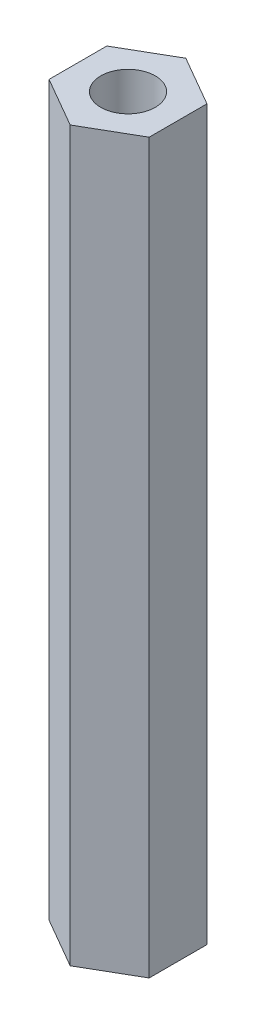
SolidWorks part; units mm, degrees
ref_plane "Front Plane" through (0, 0, 0) normal (0, 0, 1) x (1, 0, 0)
ref_plane "Top Plane" through (0, 0, 0) normal (0, 1, 0) x (1, 0, 0)
ref_plane "Right Plane" through (0, 0, 0) normal (1, 0, 0) x (0, 0, -1)
sketch "Sketch1" plane through (0, 0, 0) normal (0, 1, 0) x (1, 0, 0)
  line L1 (2.75, 1.5877) -> (0, 3.1754)
  line L2 (0, 3.1754) -> (-2.75, 1.5877)
  line L3 (-2.75, 1.5877) -> (-2.75, -1.5877)
  line L4 (-2.75, -1.5877) -> (0, -3.1754)
  line L5 (0, -3.1754) -> (2.75, -1.5877)
  line L6 (2.75, -1.5877) -> (2.75, 1.5877)
  circle A0 centre (0, 0) radius 1.5
  circle A2 centre (0, 0) radius 2.75 construction
  dimension "D1" = 3
  dimension "D2" = 5.5
extrude "Boss-Extrude1" add sketch "Sketch1" along normal blind 40
